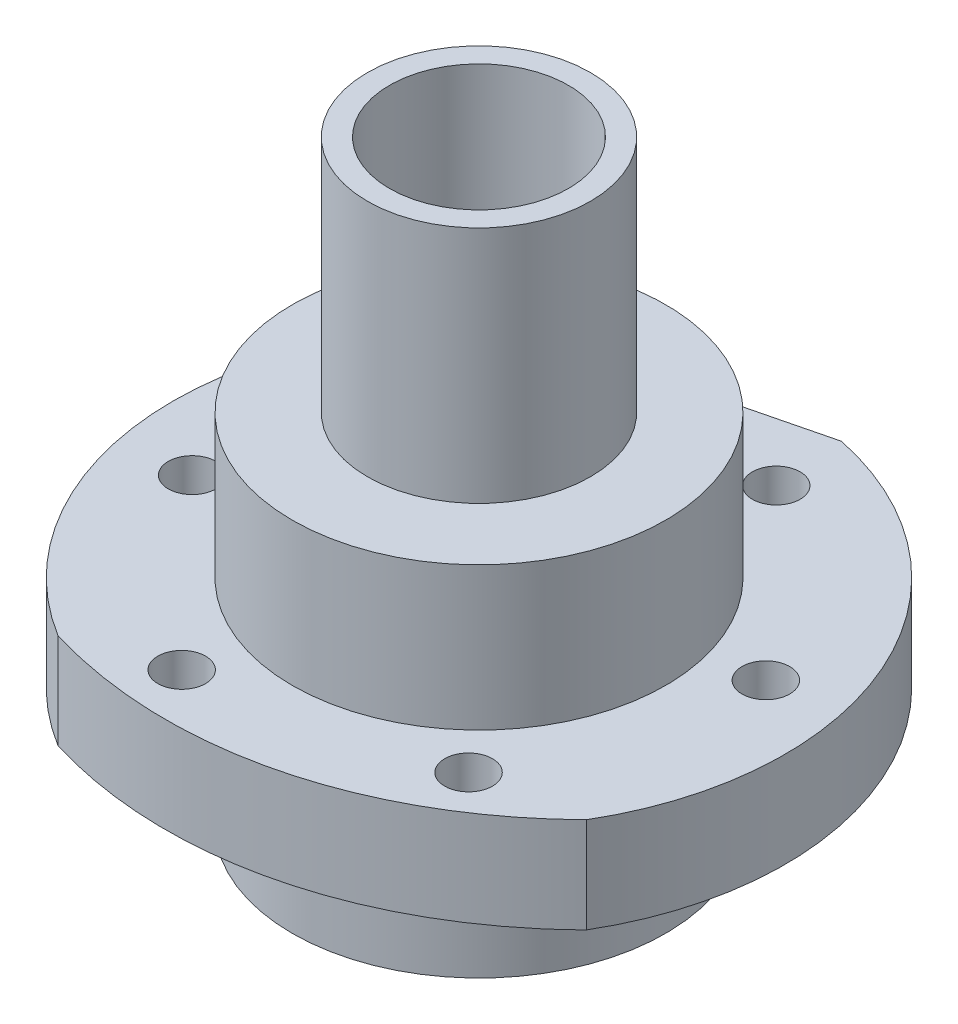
SolidWorks part; units mm, degrees
ref_plane "Front Plane" through (0, 0, 0) normal (0, 0, 1) x (1, 0, 0)
ref_plane "Top Plane" through (0, 0, 0) normal (0, 1, 0) x (1, 0, 0)
ref_plane "Right Plane" through (0, 0, 0) normal (1, 0, 0) x (0, 0, -1)
sketch "Sketch1" plane through (0, 0, 0) normal (1, 0, 0) x (0, 0, -1)
  line L0 (12.65, 0) -> (15.65, 0)
  line L4 (15.65, 30) -> (9.35, 30)
  line L5 (0, 30) -> (0, 0) construction
  line L6 (12.65, 0) -> (12.65, 22)
  line L7 (7.5, 30) -> (7.5, 50)
  line L8 (7.5, 50) -> (9.35, 50)
  line L9 (9.35, 50) -> (9.35, 30)
  line L10 (7.5, 30) -> (7.5, 27)
  line L11 (7.5, 27) -> (12.65, 27)
  line L12 (12.65, 25) -> (12.95, 25)
  line L13 (13.65, 24.3) -> (13.65, 22.7)
  line L14 (12.95, 22) -> (12.65, 22)
  line L15 (12.65, 25) -> (12.65, 27)
  line L16 (15.65, 0) -> (15.65, 10)
  line L17 (15.65, 10) -> (25.65, 10)
  line L19 (25.65, 18) -> (15.65, 18)
  line L20 (15.65, 18) -> (15.65, 30)
  line L21 (25.65, 18) -> (25.65, 10)
  arc A0 (13.65, 22.7) -> (12.95, 22) centre (12.95, 22.7) cw
  arc A1 (12.95, 25) -> (13.65, 24.3) centre (12.95, 24.3) cw
  point P20 (13.65, 22)
  point P23 (13.65, 25)
  dimension "D13" = 0.7
  dimension "D1" = 12.65
  dimension "D2" = 10
  dimension "D3" = 10
  dimension "D4" = 30
  dimension "D5" = 3
  dimension "D6" = 7.5
  dimension "D7" = 9.35
  dimension "D8" = 20
  dimension "D9" = 3
  dimension "D10" = 1
  dimension "D11" = 3
  dimension "D12" = 2
  dimension "D14" = 3
  dimension "D15" = 8
revolve "Revolve1" add sketch "Sketch1" angle 360 about L5
sketch "Sketch2" plane through (0, 18, 0) normal (0, 1, 0) x (1, 0, 0)
  line L0 (-44.377, 12.807) -> (33.2797, 32.0281) construction
  line L1 (-16.3836, 19.7357) -> (5.2863, 25.0993)
  arc A0 (-13.435, -21.85) -> (22.0759, -13.0606) centre (0, 0) ccw
  circle A1 centre (0, 0) radius 25.65
  arc A2 (5.2863, 25.0993) -> (-16.3836, 19.7357) centre (0, 0) ccw
  spline S0 degree 3 poles (-1996.7691, -418.7042) (-35.959, 64.6864) (-50.5176, 35.4113) (-43.9946, 11.3446) (-43.7875, 10.6181) (-43.5698, 9.8949) (-43.342, 9.1749) (-42.9456, 7.9812) (-42.3439, 6.3277) (-41.4814, 4.2399) (-40.5324, 2.1958) (-39.1575, -0.4594) (-37.2364, -3.6443) (-34.6224, -7.2222) (-31.7284, -10.5159) (-28.582, -13.4934) (-25.2133, -16.126) (-21.6543, -18.3882) (-17.9392, -20.2579) (-14.1036, -21.7169) (-10.1842, -22.7506) (-6.2191, -23.3487) (-2.2465, -23.505) (1.6948, -23.2178) (5.5665, -22.4898) (9.3309, -21.3278) (12.9511, -19.7434) (16.3921, -17.7521) (19.6205, -15.3735) (22.6051, -12.631) (25.3174, -9.5513) (27.7315, -6.1645) (29.8243, -2.5034) (31.5762, 1.3966) (32.9704, 5.4979) (33.994, 9.7613) (34.6372, 14.1454) (34.8509, 17.8586) (34.8286, 20.8487) (34.7145, 23.0995) (34.5036, 25.3486) (34.2474, 27.2165) (33.9948, 28.7048) (33.7811, 29.8174) (27.7888, 57.9913) (-6.2059, 79.3438) (1961.5228, 560.2341) knots -0.535266 -0.535266 -0.535266 -0.535266 0.005579 0.011156 0.016729 0.022302 0.027875 0.033449 0.050147 0.066815 0.083444 0.100024 0.132995 0.16567 0.197995 0.229926 0.261433 0.292501 0.323134 0.353351 0.383188 0.412698 0.44195 0.471021 0.5 0.528979 0.558051 0.587302 0.616812 0.646649 0.676866 0.707499 0.738568 0.770074 0.802005 0.83433 0.867006 0.899977 0.916557 0.933185 0.949854 0.966552 0.974912 0.983271 0.991632 1.612518 1.612518 1.612518 1.612518 only from (-44.377, 12.807) to (33.2797, 32.0281) construction
  spline S1 degree 3 poles (-13.435, -21.85) (-12.3548, -22.1761) (-9.9664, -22.7834) (-6.2191, -23.3487) (-2.2465, -23.505) (1.6948, -23.2178) (5.5665, -22.4898) (9.3309, -21.3278) (12.9511, -19.7434) (16.3921, -17.7521) (19.4431, -15.5042) (21.2724, -13.8529) (22.0759, -13.0606) knots 0.358219 0.358219 0.358219 0.358219 0.383188 0.412698 0.44195 0.471021 0.5 0.528979 0.558051 0.587302 0.616812 0.641781 0.641781 0.641781 0.641781
  dimension "D1" = 0
extrude "Cut-Extrude1" cut sketch "Sketch2" against normal blind 8
sketch "Sketch3" plane through (0, 18, 0) normal (0, 1, 0) x (1, 0, 0)
  line L0 (-19.4692, -4.5773) -> (0, 0) construction
  line L1 (0, 0) -> (19.4692, 4.5773) construction
  line L2 (-13.6987, 14.5721) -> (0, 0) construction
  line L3 (0, 0) -> (13.6987, -14.5721) construction
  line L4 (5.7705, 19.1495) -> (0, 0) construction
  line L5 (0, 0) -> (-5.7705, -19.1495) construction
  circle A0 centre (-5.7705, -19.1495) radius 2
  circle A1 centre (13.6987, -14.5721) radius 2
  circle A2 centre (19.4692, 4.5773) radius 2
  circle A3 centre (5.7705, 19.1495) radius 2
  circle A4 centre (-19.4692, -4.5773) radius 2
  circle A5 centre (-13.6987, 14.5721) radius 2
  dimension "D1" = 4
  dimension "D2" = 60
  dimension "D3" = 60
  dimension "D5" = 20
extrude "Cut-Extrude2" cut sketch "Sketch3" against normal blind 8
